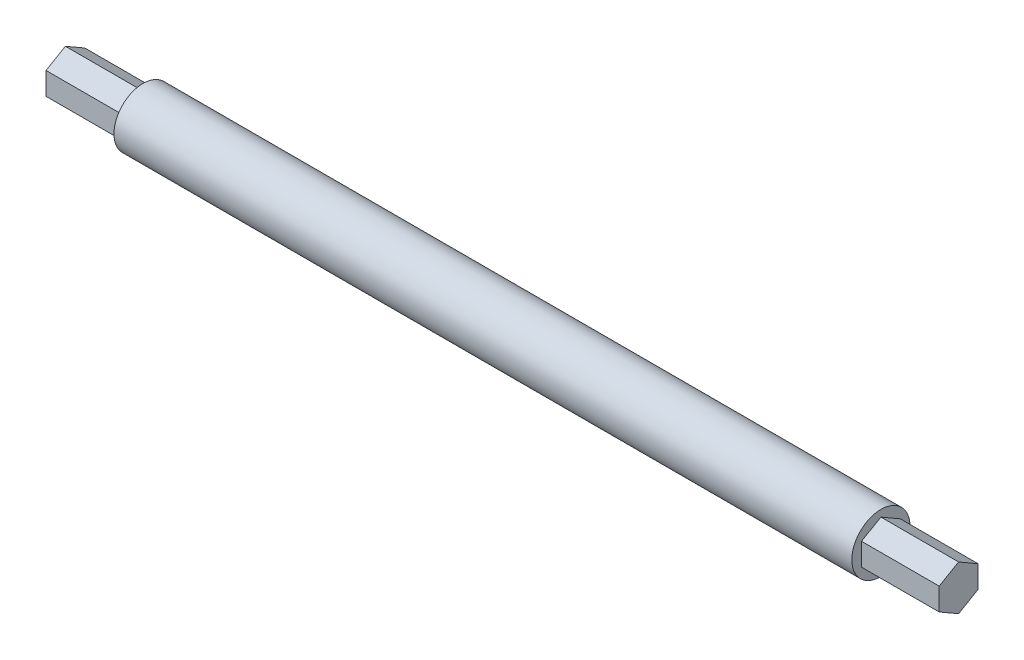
SolidWorks part; units mm, degrees
ref_plane "Спереди" through (0, 0, 0) normal (0, 0, 1) x (1, 0, 0)
ref_plane "Сверху" through (0, 0, 0) normal (0, 1, 0) x (1, 0, 0)
ref_plane "Справа" through (0, 0, 0) normal (1, 0, 0) x (0, 0, -1)
sketch "Эскиз1" plane through (0, 0, 0) normal (0, 0, 1) x (1, 0, 0)
  line L0 (0, 43.4526) -> (0, -13.4526) construction
  line L1 (-233.5474, 0) -> (270.1606, 0) construction
  line L2 (190, 0) -> (-190, 0)
  line L3 (-190, 0) -> (-190, 15)
  line L4 (-190, 15) -> (190, 15)
  line L5 (190, 0) -> (190, 15)
  point P10 (0, 0)
  point P11 (0, 15)
  dimension "D1" = 190
  dimension "D2" = 15
revolve "Повернуть1" add sketch "Эскиз1" angle 360 about L1
sketch "Эскиз2" plane through (-190, 0, 0) normal (-1, 0, 0) x (0, 0, 1)
  line L0 (0, 18.4784) -> (0, -17.5507) construction
  line L2 (0, 11.547) -> (-10, 5.7735)
  line L3 (-10, 5.7735) -> (-10, -5.7735)
  line L4 (-10, -5.7735) -> (0, -11.547)
  line L5 (0, -11.547) -> (10, -5.7735)
  line L6 (10, -5.7735) -> (10, 5.7735)
  line L7 (10, 5.7735) -> (0, 11.547)
  circle A0 centre (0, 0) radius 10 construction
  point P4 (0, 0)
  dimension "D1" = 20
extrude "Бобышка-Вытянуть1" add sketch "Эскиз2" along normal blind 40
sketch "Эскиз3" plane through (190, 0, 0) normal (1, 0, 0) x (0, 0, -1)
  line L0 (0, 18.3642) -> (0, -18.5156) construction
  line L7 (10, 5.7735) -> (0, 11.547)
  line L8 (10, -5.7735) -> (10, 5.7735)
  line L9 (0, -11.547) -> (10, -5.7735)
  line L10 (-10, -5.7735) -> (0, -11.547)
  line L11 (-10, 5.7735) -> (-10, -5.7735)
  line L12 (0, 11.547) -> (-10, 5.7735)
  line L13 (10, 5.7735) -> (0, 11.547)
  line L14 (10, -5.7735) -> (10, 5.7735)
  line L15 (0, -11.547) -> (10, -5.7735)
  line L16 (-10, -5.7735) -> (0, -11.547)
  line L17 (-10, 5.7735) -> (-10, -5.7735)
  line L18 (0, 11.547) -> (-10, 5.7735)
  dimension "D1" = 0
extrude "Бобышка-Вытянуть2" add sketch "Эскиз3" along normal blind 40
